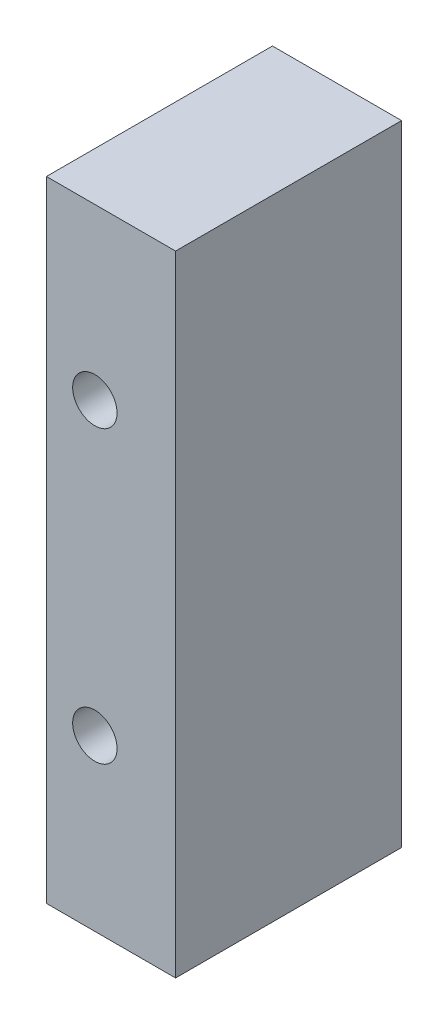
SolidWorks part; units mm, degrees
ref_plane "Face" through (0, 0, 0) normal (0, 0, 1) x (1, 0, 0)
ref_plane "Dessus" through (0, 0, 0) normal (0, 1, 0) x (1, 0, 0)
ref_plane "Droite" through (0, 0, 0) normal (1, 0, 0) x (0, 0, -1)
sketch "Esquisse1" plane through (0, 0, 0) normal (0, 0, 1) x (1, 0, 0)
  line L0 (-14.7461, 0) -> (31.0444, 0) construction
  line L1 (-8, 39) -> (8, 39)
  line L2 (-8, 39) -> (-8, -39)
  line L3 (-8, -39) -> (8, -39)
  line L4 (8, 39) -> (8, -39)
  line L5 (0, 24.2535) -> (0, -23.4774) construction
  dimension "D1" = 78
  dimension "D2" = 16
extrude "Extrusion1" add sketch "Esquisse1" along normal blind 28
sketch "Esquisse2" plane through (0, 0, 28) normal (0, 0, 1) x (1, 0, 0)
  line L0 (-5.9194, 0) -> (11.683, 0) construction
  line L1 (0, 8.3339) -> (0, -6.4646) construction
  circle A0 centre (-2, 18) radius 2.75
  circle A1 centre (-2, -18) radius 2.75
  dimension "D1" = 5.5
  dimension "D2" = 2
  dimension "D3" = 36
extrude "Enlèv. mat.-Extru.1" cut sketch "Esquisse2" against normal through all
